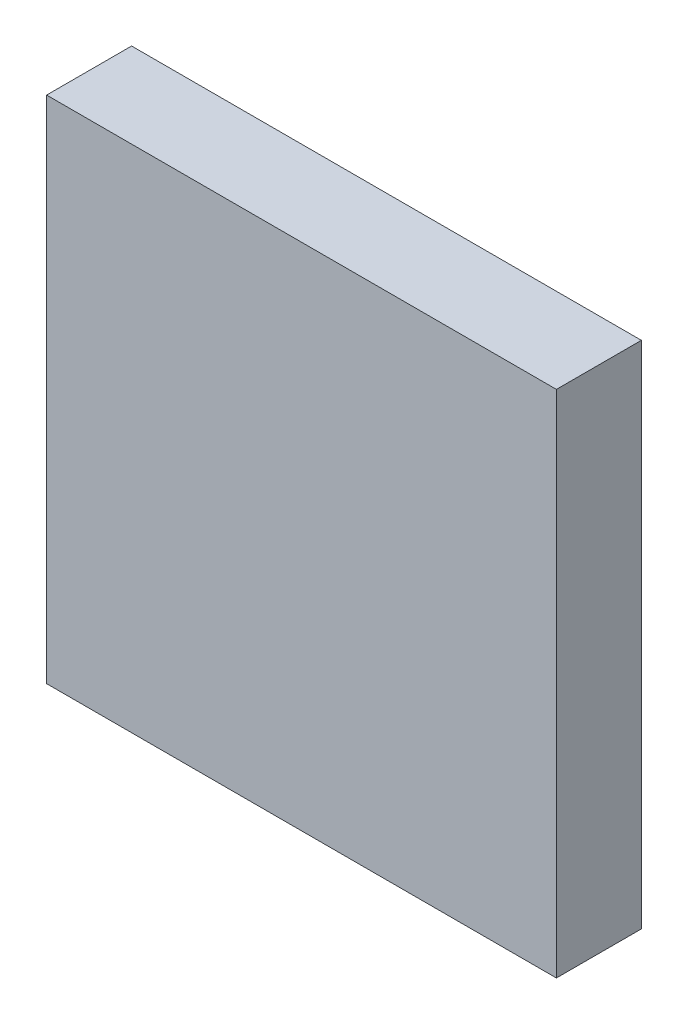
SolidWorks part; units mm, degrees
ref_plane "Front Plane" through (0, 0, 0) normal (0, 0, 1) x (1, 0, 0)
ref_plane "Top Plane" through (0, 0, 0) normal (0, 1, 0) x (1, 0, 0)
ref_plane "Right Plane" through (0, 0, 0) normal (1, 0, 0) x (0, 0, -1)
sketch "GENERAL" plane through (0, 0, 0) normal (0, 0, 1) x (1, 0, 0)
  line L4 (-3, -3) -> (3, -3)
  line L5 (3, -3) -> (3, 3)
  line L6 (3, 3) -> (-3, 3)
  line L7 (-3, 3) -> (-3, -3)
extrude "Boss-Extrude1" add sketch "GENERAL" along normal blind 1
